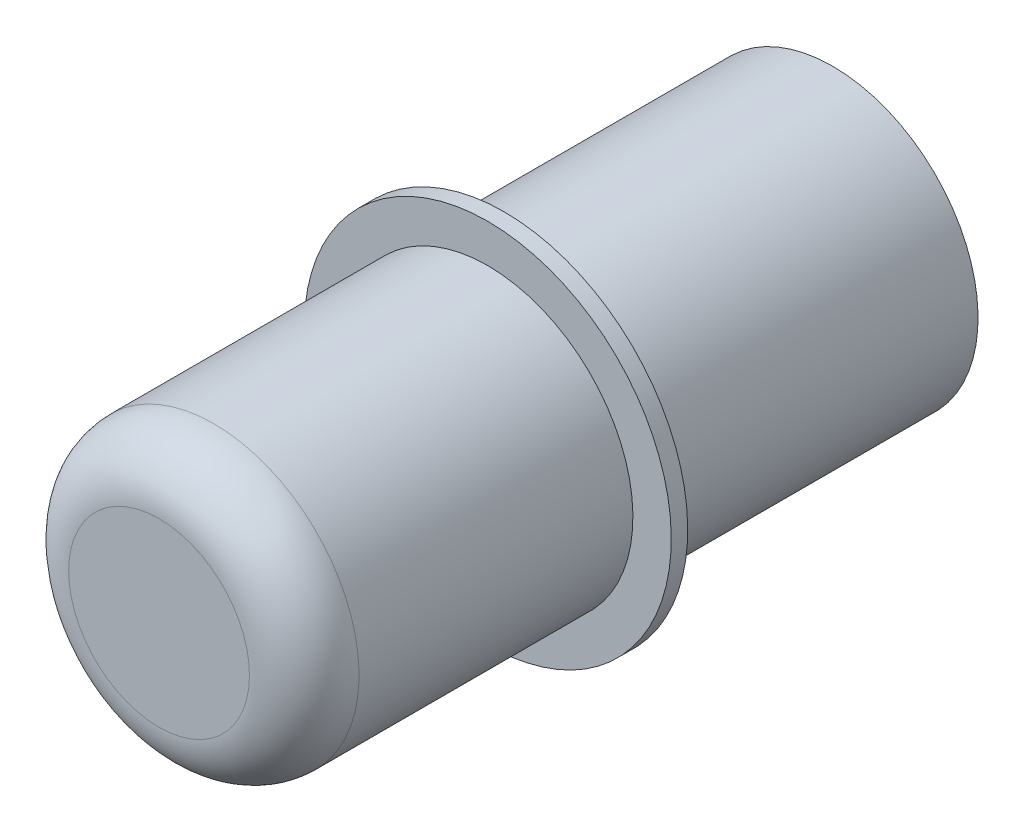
SolidWorks part; units mm, degrees
ref_plane "Plan de face" through (0, 0, 0) normal (0, 0, 1) x (1, 0, 0)
ref_plane "Plan de dessus" through (0, 0, 0) normal (0, 1, 0) x (1, 0, 0)
ref_plane "Plan de droite" through (0, 0, 0) normal (1, 0, 0) x (0, 0, -1)
sketch "Esquisse1" plane through (0, 0, 0) normal (1, 0, 0) x (0, 0, -1)
  line L0 (0, 0) -> (0, 13.25)
  line L1 (0, 13.25) -> (30, 13.25)
  line L2 (30, 13.25) -> (30, 16.75)
  line L3 (30, 16.75) -> (31.5, 16.75)
  line L5 (61.5, 0) -> (0, 0)
  line L6 (31.5, 16.75) -> (31.5, 13.25)
  line L7 (31.5, 13.25) -> (61.5, 13.25)
  line L8 (61.5, 13.25) -> (61.5, 0)
  point P6 (31.5, 16.4136)
  point P10 (45.0542, 0)
  dimension "D1" = 13.25
  dimension "D2" = 16.75
  dimension "D3" = 1.5
  dimension "D4" = 30
  dimension "D5" = 30
revolve "Révolution1" add sketch "Esquisse1" angle 360 about L5
fillet "Congé1" radius 5 1 edges at (0, 13.25, 0)
sketch "Esquisse2" plane through (0, 0, -61.5) normal (0, 0, -1) x (-1, 0, 0)
  circle A0 centre (0, 0) radius 7
  dimension "D1" = 14
extrude "Enlèv. mat.-Extru.1" cut sketch "Esquisse2" against normal blind 18
